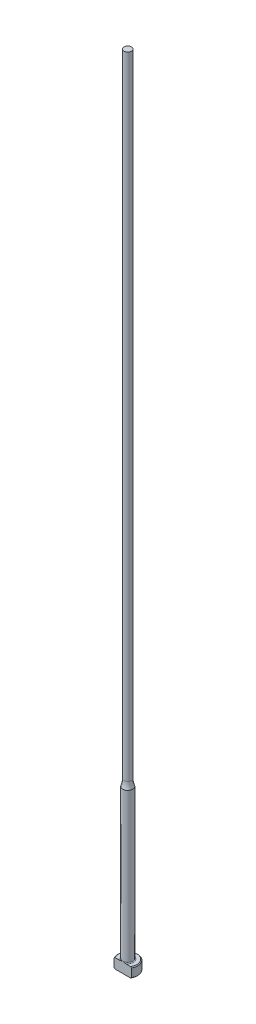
SolidWorks part; units mm, degrees
ref_plane "Front Plane" through (0, 0, 0) normal (0, 0, 1) x (1, 0, 0)
ref_plane "Top Plane" through (0, 0, 0) normal (0, 1, 0) x (1, 0, 0)
ref_plane "Right Plane" through (0, 0, 0) normal (1, 0, 0) x (0, 0, -1)
sketch "Sketch1" plane through (0, 0, 0) normal (0, 0, 1) x (1, 0, 0)
  line L0 (0, 259.9588) -> (0, -15.1925) construction
  line L1 (0, 0) -> (-3.175, 0)
  line L2 (-3.175, 0) -> (-3.175, 3.175)
  line L3 (-3.175, 3.175) -> (-1.5875, 3.175)
  line L4 (-1.19, 53.0114) -> (-1.19, 254)
  line L5 (-1.19, 254) -> (0, 254)
  line L6 (0, 254) -> (0, 0)
  line L7 (-1.5875, 3.175) -> (-1.5875, 50.8)
  arc A0 (-1.5875, 50.8) -> (-1.19, 53.0114) centre (-7.54, 53.0114) ccw
  point P13 (-1.5875, 0)
  dimension "D1" = 6.35
  dimension "L" = 254
  dimension "D2" = 3.175
  dimension "H" = 6.35
  dimension "T" = 3.175
  dimension "D" = 2.38
  dimension "S" = 50.8
revolve "Revolve1" add sketch "Sketch1" angle 360 about L0
chamfer "Chamfer1" distance 0.254 angle 45 2 edges at (0, 3.175, 3.175) (0, 0, 3.175)
fillet "Fillet1" radius 0.254 1 edges at (0, 3.175, 1.5875)
sketch "Sketch2" plane through (0, 0, 0) normal (0, -1, 0) x (1, 0, 0)
  line L0 (-2.7496, 1.5875) -> (2.7496, 1.5875)
  circle A0 centre (0, 0) radius 3.175 construction
  arc A1 (2.7496, 1.5875) -> (-2.7496, 1.5875) centre (0, 0) ccw
  circle A4 centre (0, 0) radius 1.5875 construction
  dimension "D1" = 0
extrude "KEY" cut sketch "Sketch2" against normal through all
